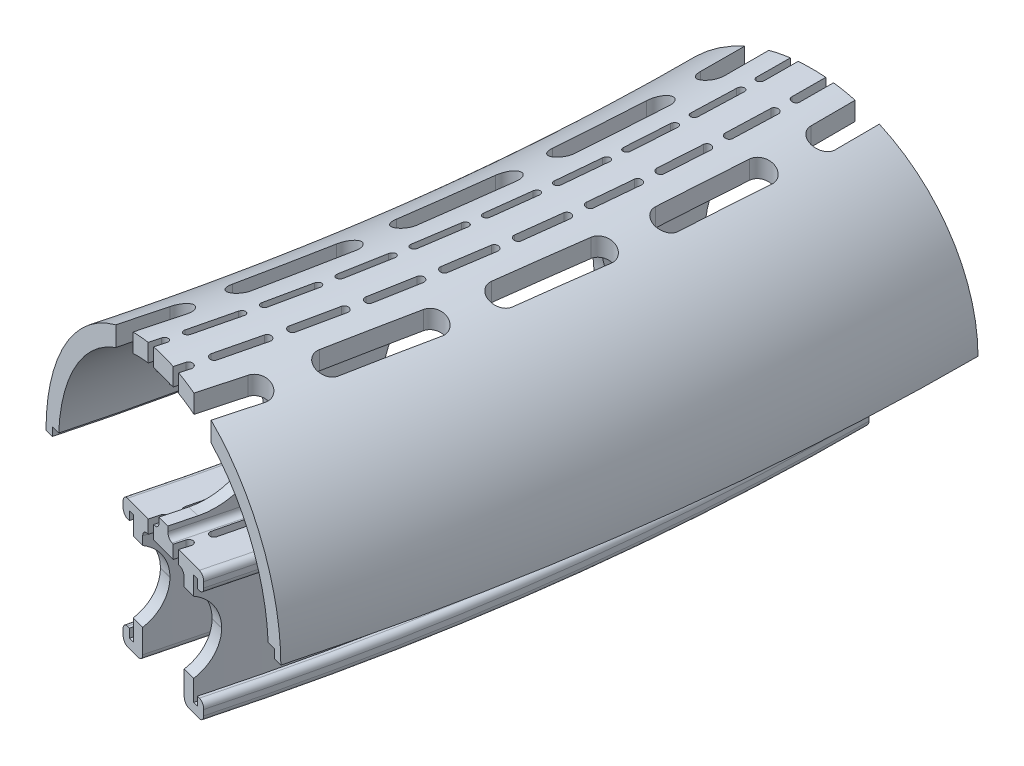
SolidWorks part; units mm, degrees
ref_plane "Спереди" through (0, 0, 0) normal (0, 0, 1) x (1, 0, 0)
ref_plane "Сверху" through (0, 0, 0) normal (0, 1, 0) x (1, 0, 0)
ref_plane "Справа" through (0, 0, 0) normal (1, 0, 0) x (0, 0, -1)
sketch "Эскиз1" plane through (0, 0, 0) normal (0, 0, 1) x (1, 0, 0)
  line L29 (195.65, 0.25) -> (196.15, 0.25)
  line L31 (195.65, -9.75) -> (196.15, -9.75)
  line L33 (195.4, -0.55) -> (195.65, -0.55)
  line L35 (195.4, -8.95) -> (195.65, -8.95)
  line L40 (195.65, 0.25) -> (195.65, -0.55)
  line L46 (194.85, -10) -> (194.85, -9.5)
  line L50 (194.85, 0) -> (194.85, 0.5)
  line L51 (195.65, -8.95) -> (195.65, -9.75)
  line L52 (196.15, 0.25) -> (196.15, -9.75)
  line L56 (185.8213, 0.7768) -> (186.6225, 0.7768)
  line L58 (185, 0) -> (185.8, 0)
  line L62 (214.2, 0) -> (215, 0)
  line L63 (213.3775, 0.7768) -> (214.1787, 0.7768)
  line L65 (0, 44.1102) -> (0, 0) construction
  line L68 (199.4347, 12.8015) -> (199.4347, 1.6)
  line L71 (195.4, 1.05) -> (198.8847, 1.05)
  line L72 (197.9, -0.15) -> (202.1, -0.15)
  line L73 (197.35, -0.7) -> (197.35, -10)
  line L74 (195.4, -10.55) -> (196.8, -10.55)
  line L75 (200, 12.0049) -> (200, -5.7785) construction
  line L76 (204.6, -10.55) -> (203.2, -10.55)
  line L77 (202.65, -0.7) -> (202.65, -10)
  line L78 (204.6, 1.05) -> (201.1153, 1.05)
  line L79 (200.5653, 12.8015) -> (200.5653, 1.6)
  line L80 (203.85, 0.25) -> (203.85, -9.75)
  line L81 (204.35, -8.95) -> (204.35, -9.75)
  line L82 (205.15, 0) -> (205.15, 0.5)
  line L83 (205.15, -10) -> (205.15, -9.5)
  line L84 (204.35, 0.25) -> (204.35, -0.55)
  line L85 (204.6, -8.95) -> (204.35, -8.95)
  line L86 (204.6, -0.55) -> (204.35, -0.55)
  line L87 (204.35, -9.75) -> (203.85, -9.75)
  line L88 (204.35, 0.25) -> (203.85, 0.25)
  arc A0 (215, 0) -> (185, 0) centre (200, 0) ccw
  arc A2 (198.837, 13.3494) -> (186.6225, 0.7768) centre (200, 0) ccw
  arc A3 (194.85, 0.5) -> (195.4, 1.05) centre (195.4, 0.5) cw
  arc A4 (195.4, -0.55) -> (194.85, 0) centre (195.4, 0) cw
  arc A7 (195.4, -8.95) -> (194.85, -9.5) centre (195.4, -9.5) ccw
  arc A10 (195.4, -10.55) -> (194.85, -10) centre (195.4, -10) cw
  arc A15 (213.3775, 0.7768) -> (201.163, 13.3494) centre (200, 0) ccw
  arc A18 (185.8213, 0.7768) -> (185.8, 0) centre (200, 0) ccw
  arc A19 (214.2, 0) -> (214.1787, 0.7768) centre (200, 0) ccw
  arc A20 (214.2, 0) -> (200.6174, 14.1866) centre (200, 0) ccw construction
  arc A21 (213.4, 0) -> (200.5826, 13.3873) centre (200, 0) ccw construction
  arc A22 (199.4174, 13.3873) -> (186.6, 0) centre (200, 0) ccw construction
  arc A23 (199.3826, 14.1866) -> (185.8, 0) centre (200, 0) ccw construction
  arc A24 (198.837, 13.3494) -> (199.4347, 12.8015) centre (198.8847, 12.8015) cw
  arc A25 (200.5653, 12.8015) -> (201.163, 13.3494) centre (201.1153, 12.8015) cw
  arc A28 (197.35, -10) -> (196.8, -10.55) centre (196.8, -10) cw
  arc A29 (198.8847, 1.05) -> (199.4347, 1.6) centre (198.8847, 1.6) ccw
  arc A30 (197.9, -0.15) -> (197.35, -0.7) centre (197.9, -0.7) ccw
  arc A31 (202.1, -0.15) -> (202.65, -0.7) centre (202.1, -0.7) cw
  arc A32 (201.1153, 1.05) -> (200.5653, 1.6) centre (201.1153, 1.6) cw
  arc A33 (202.65, -10) -> (203.2, -10.55) centre (203.2, -10) ccw
  arc A34 (204.6, -10.55) -> (205.15, -10) centre (204.6, -10) ccw
  arc A35 (204.6, -8.95) -> (205.15, -9.5) centre (204.6, -9.5) cw
  arc A36 (204.6, -0.55) -> (205.15, 0) centre (204.6, 0) ccw
  arc A37 (205.15, 0.5) -> (204.6, 1.05) centre (204.6, 0.5) ccw
  point P39 (194.85, -0.55)
  point P58 (196.15, -7.55)
  point P60 (203.85, -7.55)
  point P61 (200, -0.15)
  dimension "D1" = 30
  dimension "D3" = 1.6
  dimension "D13" = 0.8
  dimension "D14" = 4.2
  dimension "D17" = 0.55
  dimension "D4" = 1.2
  dimension "D6" = 0.55
  dimension "D2" = 200
  dimension "D5" = 1.2
  dimension "D7" = 10
  dimension "D8" = 0.8
  dimension "D9" = 0.5
  dimension "D10" = 0.8
  dimension "D11" = 0.8
  dimension "D12" = 0.8
  dimension "D15" = 0.8
revolve "Повернуть1" add sketch "Эскиз1" angle 15 about L65
sketch "Эскиз3" plane through (0, 0, 0) normal (-0.2588, 0, 0.9659) x (0.9659, 0, 0.2588)
  line L0 (0, 58.5351) -> (0, -22.4397) construction
  line L31 (185, 0) -> (185.8, 0)
  line L32 (185.8213, 0.7768) -> (186.6225, 0.7768)
  line L33 (199.4347, 12.8015) -> (199.4347, 1.6)
  line L34 (198.8847, 1.05) -> (195.4, 1.05)
  line L35 (194.85, 0.5) -> (194.85, 0)
  line L36 (195.4, -0.55) -> (195.65, -0.55)
  line L37 (195.65, -0.55) -> (195.65, 0.25)
  line L38 (195.65, 0.25) -> (196.15, 0.25)
  line L39 (196.15, 0.25) -> (196.15, -9.75)
  line L40 (196.15, -9.75) -> (195.65, -9.75)
  line L41 (195.65, -9.75) -> (195.65, -8.95)
  line L42 (195.65, -8.95) -> (195.4, -8.95)
  line L43 (194.85, -9.5) -> (194.85, -10)
  line L44 (195.4, -10.55) -> (196.8, -10.55)
  line L45 (197.35, -10) -> (197.35, -0.7)
  line L46 (197.9, -0.15) -> (202.1, -0.15)
  line L47 (202.65, -0.7) -> (202.65, -10)
  line L48 (203.2, -10.55) -> (204.6, -10.55)
  line L49 (205.15, -10) -> (205.15, -9.5)
  line L50 (204.6, -8.95) -> (204.35, -8.95)
  line L51 (204.35, -8.95) -> (204.35, -9.75)
  line L52 (204.35, -9.75) -> (203.85, -9.75)
  line L53 (203.85, -9.75) -> (203.85, 0.25)
  line L54 (203.85, 0.25) -> (204.35, 0.25)
  line L55 (204.35, 0.25) -> (204.35, -0.55)
  line L56 (204.35, -0.55) -> (204.6, -0.55)
  line L57 (205.15, 0) -> (205.15, 0.5)
  line L58 (204.6, 1.05) -> (201.1153, 1.05)
  line L59 (200.5653, 1.6) -> (200.5653, 12.8015)
  line L60 (213.3775, 0.7768) -> (214.1787, 0.7768)
  line L61 (214.2, 0) -> (215, 0)
  line L63 (185.8213, 0.7768) -> (186.6225, 0.7768)
  line L64 (199.4347, 12.8015) -> (199.4347, 1.6)
  line L65 (198.8847, 1.05) -> (195.4, 1.05)
  line L66 (194.85, 0.5) -> (194.85, 0)
  line L67 (195.4, -0.55) -> (195.65, -0.55)
  line L68 (195.65, -0.55) -> (195.65, 0.25)
  line L69 (195.65, 0.25) -> (196.15, 0.25)
  line L70 (196.15, 0.25) -> (196.15, -9.75)
  line L71 (196.15, -9.75) -> (195.65, -9.75)
  line L72 (195.65, -9.75) -> (195.65, -8.95)
  line L73 (195.65, -8.95) -> (195.4, -8.95)
  line L74 (194.85, -9.5) -> (194.85, -10)
  line L75 (195.4, -10.55) -> (196.8, -10.55)
  line L76 (197.35, -10) -> (197.35, -0.7)
  line L77 (197.9, -0.15) -> (202.1, -0.15)
  line L78 (202.65, -0.7) -> (202.65, -10)
  line L79 (203.2, -10.55) -> (204.6, -10.55)
  line L80 (205.15, -10) -> (205.15, -9.5)
  line L81 (204.6, -8.95) -> (204.35, -8.95)
  line L82 (204.35, -8.95) -> (204.35, -9.75)
  line L83 (204.35, -9.75) -> (203.85, -9.75)
  line L84 (203.85, -9.75) -> (203.85, 0.25)
  line L85 (203.85, 0.25) -> (204.35, 0.25)
  line L86 (204.35, 0.25) -> (204.35, -0.55)
  line L87 (204.35, -0.55) -> (204.6, -0.55)
  line L88 (205.15, 0) -> (205.15, 0.5)
  line L89 (204.6, 1.05) -> (201.1153, 1.05)
  line L90 (200.5653, 1.6) -> (200.5653, 12.8015)
  line L91 (213.3775, 0.7768) -> (214.1787, 0.7768)
  arc A0 (214.1787, 0.7768) -> (185.8213, 0.7768) centre (200, 0) ccw
  arc A21 (215, 0) -> (185, 0) centre (200, 0) ccw
  arc A22 (185.8213, 0.7768) -> (185.8, 0) centre (200, 0) ccw
  arc A23 (198.837, 13.3494) -> (186.6225, 0.7768) centre (200, 0) ccw
  arc A24 (199.4347, 12.8015) -> (198.837, 13.3494) centre (198.8847, 12.8015) ccw
  arc A25 (198.8847, 1.05) -> (199.4347, 1.6) centre (198.8847, 1.6) ccw
  arc A26 (195.4, 1.05) -> (194.85, 0.5) centre (195.4, 0.5) ccw
  arc A27 (194.85, 0) -> (195.4, -0.55) centre (195.4, 0) ccw
  arc A28 (195.4, -8.95) -> (194.85, -9.5) centre (195.4, -9.5) ccw
  arc A29 (194.85, -10) -> (195.4, -10.55) centre (195.4, -10) ccw
  arc A30 (196.8, -10.55) -> (197.35, -10) centre (196.8, -10) ccw
  arc A31 (197.9, -0.15) -> (197.35, -0.7) centre (197.9, -0.7) ccw
  arc A32 (202.65, -0.7) -> (202.1, -0.15) centre (202.1, -0.7) ccw
  arc A33 (202.65, -10) -> (203.2, -10.55) centre (203.2, -10) ccw
  arc A34 (204.6, -10.55) -> (205.15, -10) centre (204.6, -10) ccw
  arc A35 (205.15, -9.5) -> (204.6, -8.95) centre (204.6, -9.5) ccw
  arc A36 (204.6, -0.55) -> (205.15, 0) centre (204.6, 0) ccw
  arc A37 (205.15, 0.5) -> (204.6, 1.05) centre (204.6, 0.5) ccw
  arc A38 (200.5653, 1.6) -> (201.1153, 1.05) centre (201.1153, 1.6) ccw
  arc A39 (201.163, 13.3494) -> (200.5653, 12.8015) centre (201.1153, 12.8015) ccw
  arc A40 (213.3775, 0.7768) -> (201.163, 13.3494) centre (200, 0) ccw
  arc A41 (214.2, 0) -> (214.1787, 0.7768) centre (200, 0) ccw
  arc A44 (198.837, 13.3494) -> (186.6225, 0.7768) centre (200, 0) ccw
  arc A45 (199.4347, 12.8015) -> (198.837, 13.3494) centre (198.8847, 12.8015) ccw
  arc A46 (198.8847, 1.05) -> (199.4347, 1.6) centre (198.8847, 1.6) ccw
  arc A47 (195.4, 1.05) -> (194.85, 0.5) centre (195.4, 0.5) ccw
  arc A48 (194.85, 0) -> (195.4, -0.55) centre (195.4, 0) ccw
  arc A49 (195.4, -8.95) -> (194.85, -9.5) centre (195.4, -9.5) ccw
  arc A50 (194.85, -10) -> (195.4, -10.55) centre (195.4, -10) ccw
  arc A51 (196.8, -10.55) -> (197.35, -10) centre (196.8, -10) ccw
  arc A52 (197.9, -0.15) -> (197.35, -0.7) centre (197.9, -0.7) ccw
  arc A53 (202.65, -0.7) -> (202.1, -0.15) centre (202.1, -0.7) ccw
  arc A54 (202.65, -10) -> (203.2, -10.55) centre (203.2, -10) ccw
  arc A55 (204.6, -10.55) -> (205.15, -10) centre (204.6, -10) ccw
  arc A56 (205.15, -9.5) -> (204.6, -8.95) centre (204.6, -9.5) ccw
  arc A57 (204.6, -0.55) -> (205.15, 0) centre (204.6, 0) ccw
  arc A58 (205.15, 0.5) -> (204.6, 1.05) centre (204.6, 0.5) ccw
  arc A59 (200.5653, 1.6) -> (201.1153, 1.05) centre (201.1153, 1.6) ccw
  arc A60 (201.163, 13.3494) -> (200.5653, 12.8015) centre (201.1153, 12.8015) ccw
  arc A61 (213.3775, 0.7768) -> (201.163, 13.3494) centre (200, 0) ccw
  dimension "D1" = 0
revolve "Повернуть2" add sketch "Эскиз3" angle 0.3 about L0
sketch "Эскиз5" plane through (0, -0.15, 0) normal (0, -1, 0) x (1, 0, 0)
  line L0 (193.8128, 49.4175) -> (195.1639, 43.8469) construction
  line L1 (195.4483, 49.4623) -> (196.3911, 45.575) construction
  line L2 (193.927, 55.1259) -> (194.9825, 51.2677) construction
  line L3 (194.2646, 55.2183) -> (195.3201, 51.36)
  line L4 (193.5894, 55.0336) -> (194.6449, 51.1753)
  line L5 (192.2935, 55.0336) -> (193.8061, 49.5046) construction
  line L6 (190.8404, 54.2815) -> (191.8959, 50.4233) construction
  line L7 (190.5029, 54.1892) -> (191.5583, 50.3309)
  line L8 (191.178, 54.3739) -> (192.2335, 50.5157)
  line L9 (195.7884, 49.5448) -> (196.7313, 45.6575)
  line L10 (195.1082, 49.3798) -> (196.051, 45.4925)
  line L11 (192.3385, 48.708) -> (193.2813, 44.8207) construction
  line L12 (191.9983, 48.6255) -> (192.9412, 44.7382)
  line L13 (192.6786, 48.7905) -> (193.6214, 44.9032)
  line L14 (195.1681, 43.7596) -> (196.3566, 38.152) construction
  line L15 (196.8042, 43.7568) -> (197.6336, 39.8437) construction
  line L16 (197.1466, 43.8294) -> (197.976, 39.9163)
  line L17 (196.4618, 43.6842) -> (197.2912, 39.7712)
  line L18 (193.6738, 43.0933) -> (194.5031, 39.1802) construction
  line L19 (193.3314, 43.0207) -> (194.1607, 39.1077)
  line L20 (194.0162, 43.1659) -> (194.8455, 39.2528)
  line L21 (196.3583, 38.0647) -> (197.3832, 32.4249) construction
  line L22 (197.9936, 38.0143) -> (198.7088, 34.0788) construction
  line L23 (198.338, 38.0769) -> (199.0532, 34.1413)
  line L24 (197.6493, 37.9517) -> (198.3645, 34.0162)
  line L25 (194.8452, 37.4421) -> (195.5604, 33.5066) construction
  line L26 (194.5008, 37.3795) -> (195.216, 33.444)
  line L27 (195.1895, 37.5047) -> (195.9048, 33.5692)
  line L28 (197.3823, 32.3375) -> (198.2427, 26.6704) construction
  line L29 (199.0155, 32.2396) -> (199.6159, 28.2849) construction
  line L30 (199.3615, 32.2922) -> (199.962, 28.3375)
  line L31 (198.6695, 32.1871) -> (199.2699, 28.2324)
  line L32 (195.8518, 31.7593) -> (196.4522, 27.8046) construction
  line L33 (195.5057, 31.7067) -> (196.1062, 27.7521)
  line L34 (196.1978, 31.8118) -> (196.7982, 27.8571)
  line L35 (198.2393, 26.583) -> (198.9346, 20.8932) construction
  line L36 (199.869, 26.4377) -> (200.3541, 22.4672) construction
  line L37 (200.2164, 26.4801) -> (200.7016, 22.5097)
  line L38 (199.5216, 26.3952) -> (200.0067, 22.4248)
  line L39 (196.6926, 26.0495) -> (197.1778, 22.0791) construction
  line L40 (196.3452, 26.0071) -> (196.8304, 22.0366)
  line L41 (197.04, 26.092) -> (197.5252, 22.1215)
  line L42 (198.9286, 20.8061) -> (199.4581, 15.0985) construction
  line L43 (200.5534, 20.6134) -> (200.9228, 16.6305) construction
  line L44 (200.9019, 20.6457) -> (201.2713, 16.6628)
  line L45 (200.2049, 20.581) -> (200.5743, 16.5981)
  line L46 (197.367, 20.3178) -> (197.7365, 16.3349) construction
  line L47 (197.0185, 20.2854) -> (197.388, 16.3025)
  line L48 (197.7155, 20.3501) -> (198.085, 16.3672)
  line L49 (199.4496, 15.0115) -> (199.8128, 9.2909) construction
  line L50 (201.068, 14.7716) -> (201.3215, 10.7796) construction
  line L51 (201.4173, 14.7938) -> (201.6708, 10.8018)
  line L52 (200.7188, 14.7494) -> (200.9722, 10.7575)
  line L53 (197.8745, 14.5688) -> (198.128, 10.5769) construction
  line L54 (197.5252, 14.5466) -> (197.7787, 10.5547)
  line L55 (198.2238, 14.591) -> (198.4773, 10.599)
  line L56 (199.8018, 9.2042) -> (199.9985, 3.4755) construction
  line L57 (201.4126, 8.9173) -> (201.5499, 4.9197) construction
  line L58 (201.7624, 8.9294) -> (201.8997, 4.9317)
  line L59 (201.0628, 8.9053) -> (201.2001, 4.9077)
  line L60 (198.2145, 8.8075) -> (198.3518, 4.8099) construction
  line L61 (197.8647, 8.7955) -> (198.002, 4.7979)
  line L62 (198.5643, 8.8195) -> (198.7016, 4.8219)
  line L63 (199.985, 3.3891) -> (200.015, -2.3429) construction
  line L64 (201.5868, 3.0555) -> (201.6077, -0.9444) construction
  line L65 (201.9368, 3.0574) -> (201.9577, -0.9426)
  line L66 (201.2368, 3.0537) -> (201.2577, -0.9462)
  line L67 (198.3868, 3.0388) -> (198.4078, -0.9612) construction
  line L68 (198.0368, 3.037) -> (198.0578, -0.963)
  line L69 (198.7368, 3.0406) -> (198.7577, -0.9593)
  arc A0 (195.7884, 49.5448) -> (195.1082, 49.3798) centre (195.4483, 49.4623) ccw
  arc A1 (196.051, 45.4925) -> (196.7313, 45.6575) centre (196.3911, 45.575) ccw
  arc A2 (191.9983, 48.6255) -> (192.6786, 48.7905) centre (192.3385, 48.708) cw
  arc A3 (193.6214, 44.9032) -> (192.9412, 44.7382) centre (193.2813, 44.8207) cw
  arc A4 (197.1466, 43.8294) -> (196.4618, 43.6842) centre (196.8042, 43.7568) ccw
  arc A5 (197.2912, 39.7712) -> (197.976, 39.9163) centre (197.6336, 39.8437) ccw
  arc A6 (193.3314, 43.0207) -> (194.0162, 43.1659) centre (193.6738, 43.0933) cw
  arc A7 (194.8455, 39.2528) -> (194.1607, 39.1077) centre (194.5031, 39.1802) cw
  arc A8 (194.2646, 55.2183) -> (193.5894, 55.0336) centre (193.927, 55.1259) ccw
  arc A9 (194.6449, 51.1753) -> (195.3201, 51.36) centre (194.9825, 51.2677) ccw
  arc A10 (190.5029, 54.1892) -> (191.178, 54.3739) centre (190.8404, 54.2815) cw
  arc A11 (192.2335, 50.5157) -> (191.5583, 50.3309) centre (191.8959, 50.4233) cw
  arc A12 (198.338, 38.0769) -> (197.6493, 37.9517) centre (197.9936, 38.0143) ccw
  arc A13 (198.3645, 34.0162) -> (199.0532, 34.1413) centre (198.7088, 34.0788) ccw
  arc A14 (194.5008, 37.3795) -> (195.1895, 37.5047) centre (194.8452, 37.4421) cw
  arc A15 (195.9048, 33.5692) -> (195.216, 33.444) centre (195.5604, 33.5066) cw
  arc A16 (199.3615, 32.2922) -> (198.6695, 32.1871) centre (199.0155, 32.2396) ccw
  arc A17 (199.2699, 28.2324) -> (199.962, 28.3375) centre (199.6159, 28.2849) ccw
  arc A18 (195.5057, 31.7067) -> (196.1978, 31.8118) centre (195.8518, 31.7593) cw
  arc A19 (196.7982, 27.8571) -> (196.1062, 27.7521) centre (196.4522, 27.8046) cw
  arc A20 (200.2164, 26.4801) -> (199.5216, 26.3952) centre (199.869, 26.4377) ccw
  arc A21 (200.0067, 22.4248) -> (200.7016, 22.5097) centre (200.3541, 22.4672) ccw
  arc A22 (196.3452, 26.0071) -> (197.04, 26.092) centre (196.6926, 26.0495) cw
  arc A23 (197.5252, 22.1215) -> (196.8304, 22.0366) centre (197.1778, 22.0791) cw
  arc A24 (200.9019, 20.6457) -> (200.2049, 20.581) centre (200.5534, 20.6134) ccw
  arc A25 (200.5743, 16.5981) -> (201.2713, 16.6628) centre (200.9228, 16.6305) ccw
  arc A26 (197.0185, 20.2854) -> (197.7155, 20.3501) centre (197.367, 20.3178) cw
  arc A27 (198.085, 16.3672) -> (197.388, 16.3025) centre (197.7365, 16.3349) cw
  arc A28 (201.4173, 14.7938) -> (200.7188, 14.7494) centre (201.068, 14.7716) ccw
  arc A29 (200.9722, 10.7575) -> (201.6708, 10.8018) centre (201.3215, 10.7796) ccw
  arc A30 (197.5252, 14.5466) -> (198.2238, 14.591) centre (197.8745, 14.5688) cw
  arc A31 (198.4773, 10.599) -> (197.7787, 10.5547) centre (198.128, 10.5769) cw
  arc A32 (201.7624, 8.9294) -> (201.0628, 8.9053) centre (201.4126, 8.9173) ccw
  arc A33 (201.2001, 4.9077) -> (201.8997, 4.9317) centre (201.5499, 4.9197) ccw
  arc A34 (197.8647, 8.7955) -> (198.5643, 8.8195) centre (198.2145, 8.8075) cw
  arc A35 (198.7016, 4.8219) -> (198.002, 4.7979) centre (198.3518, 4.8099) cw
  arc A36 (201.9368, 3.0574) -> (201.2368, 3.0537) centre (201.5868, 3.0555) ccw
  arc A37 (201.2577, -0.9462) -> (201.9577, -0.9426) centre (201.6077, -0.9444) ccw
  arc A38 (198.0368, 3.037) -> (198.7368, 3.0406) centre (198.3868, 3.0388) cw
  arc A39 (198.7577, -0.9593) -> (198.0578, -0.963) centre (198.4078, -0.9612) cw
  point P4 (195.9197, 47.5186)
  point P14 (194.4548, 53.1968)
  point P24 (191.3682, 52.3524)
  point P29 (192.8099, 46.7644)
  point P36 (197.2189, 41.8003)
  point P45 (194.0884, 41.1368)
  point P52 (198.3512, 36.0465)
  point P61 (195.2028, 35.4744)
  point P68 (199.3157, 30.2623)
  point P77 (196.152, 29.7819)
  point P84 (200.1116, 24.4524)
  point P93 (196.9352, 24.0643)
  point P100 (200.7381, 18.6219)
  point P109 (197.5518, 18.3263)
  point P116 (201.1948, 12.7756)
  point P125 (198.0012, 12.5728)
  point P132 (201.4812, 6.9185)
  point P141 (198.2831, 6.8087)
  point P148 (201.5972, 1.0556)
  point P157 (198.3973, 1.0388)
  point P162 (0, 0)
  dimension "D1" = 4
  dimension "D2" = 10
  dimension "D3" = 0.7
extrude "Вырез-Вытянуть1" cut sketch "Эскиз5" against normal blind 20
ref_plane "Плоскость1" through (0, 2.05, 0) normal (0, 1, 0) x (1, 0, 0)
sketch "Эскиз6" plane through (0, 2.05, 0) normal (0, 1, 0) x (1, 0, 0)
  line L3 (198.9552, -9.8734) -> (200.5533, -9.9511)
  line L4 (198.9552, 7.7728) -> (200.5533, 7.8505)
  line L5 (195.9643, -35.7578) -> (197.5386, -36.0435)
  line L6 (198.2676, -18.2626) -> (199.8622, -18.3941)
  line L7 (189.6205, -61.0304) -> (191.144, -61.5191)
  line L8 (194.1877, -43.9855) -> (195.7514, -44.324)
  arc A6 (200.5533, -9.9511) -> (200.7973, -1.0503) centre (0, 0) ccw
  arc A7 (200.5533, 7.8505) -> (200.7973, -1.0503) centre (0, -2.1007) cw
  arc A8 (198.9552, 7.7728) -> (199.1972, -1.0503) centre (0, -2.1007) cw
  arc A9 (198.9552, -9.8734) -> (199.1972, -1.0503) centre (0, 0) ccw
  arc A10 (197.5386, -36.0435) -> (198.9423, -27.2506) centre (0, 0) ccw
  arc A11 (199.8622, -18.3941) -> (198.9423, -27.2506) centre (-0.2742, -2.0827) cw
  arc A12 (198.2676, -18.2626) -> (197.356, -27.0418) centre (-0.2742, -2.0827) cw
  arc A13 (195.9643, -35.7578) -> (197.356, -27.0418) centre (0, 0) ccw
  arc A14 (191.144, -61.5191) -> (193.6834, -52.9847) centre (0, 0) ccw
  arc A15 (195.7514, -44.324) -> (193.6834, -52.9847) centre (-0.5437, -2.0291) cw
  arc A16 (194.1877, -43.9855) -> (192.1379, -52.5706) centre (-0.5437, -2.0291) cw
  arc A17 (189.6205, -61.0304) -> (192.1379, -52.5706) centre (0, 0) ccw
  point P29 (0, 0)
  dimension "D1" = 3
extrude "Вырез-Вытянуть3" cut sketch "Эскиз6" along normal blind 11.3
fillet "Скругление1" radius 5.6 8 edges at (195.0606, 2.05, 44.1744) (194.9696, 13.35, 44.1547) (196.7515, 2.05, 35.9007) (196.7515, 13.35, 35.9007) (199.1577, 2.05, 18.336) (199.0649, 13.35, 18.3284) (199.7542, 2.05, 9.9123) (199.7542, 13.35, 9.9123)
sketch "Эскиз7" plane through (0, -0.15, 0) normal (0, -1, 0) x (1, 0, 0)
  line L1 (188.4745, 51.5608) -> (197.3484, 53.9884) construction
  line L5 (189.8298, 48.7918) -> (191.3791, 49.1916)
  line L6 (188.2315, 54.6341) -> (189.7686, 55.0785)
  line L7 (196.0267, 50.3913) -> (197.576, 50.7912)
  line L8 (194.3797, 56.4118) -> (195.9167, 56.8562)
  arc A8 (191.3791, 49.1916) -> (189.7686, 55.0785) centre (0, 0) ccw
  arc A9 (189.8298, 48.7918) -> (188.2315, 54.6341) centre (0, 0) ccw
  arc A10 (197.576, 50.7912) -> (195.9167, 56.8562) centre (0, 0) ccw
  arc A11 (196.0267, 50.3913) -> (194.3797, 56.4118) centre (0, 0) ccw
ref_plane "Плоскость2" through (0, -1.15, 0) normal (0, -1, 0) x (-1, 0, 0)
sketch "Эскиз8" plane through (0, -1.15, 0) normal (0, -1, 0) x (-1, 0, 0)
  line L0 (-192.1232, -38.79) -> (-193.6913, -39.1082)
  line L1 (-192.3911, -45.0713) -> (-190.8329, -44.708)
  line L2 (-189.8298, -48.7918) -> (-191.3791, -49.1916)
  line L3 (-189.7686, -55.0785) -> (-188.2315, -54.6341)
  line L4 (-189.8298, -48.7918) -> (-191.3791, -49.1916)
  line L5 (-189.7686, -55.0785) -> (-188.2315, -54.6341)
  line L6 (-195.9167, -56.8562) -> (-194.3797, -56.4118)
  line L7 (-196.0267, -50.3913) -> (-197.576, -50.7912)
  line L8 (-195.9167, -56.8562) -> (-194.3797, -56.4118)
  line L9 (-196.0267, -50.3913) -> (-197.576, -50.7912)
  line L10 (-198.6239, -46.5248) -> (-197.0657, -46.1615)
  line L11 (-198.3954, -40.063) -> (-199.9634, -40.3812)
  line L12 (-193.89, -28.6819) -> (-195.4726, -28.9176)
  line L13 (-194.4863, -34.9406) -> (-192.9112, -34.6593)
  line L14 (-200.7866, -36.0659) -> (-199.2115, -35.7846)
  line L15 (-200.2202, -29.6249) -> (-201.8027, -29.8606)
  line L16 (-195.1254, -18.4951) -> (-196.7181, -18.6477)
  line L17 (-196.0484, -24.7141) -> (-194.4608, -24.5156)
  line L18 (-202.399, -25.5081) -> (-200.8113, -25.3096)
  line L19 (-201.4962, -19.1056) -> (-203.089, -19.2582)
  line L20 (-195.826, -8.2577) -> (-197.4245, -8.3267)
  line L21 (-197.0732, -14.4198) -> (-195.4773, -14.3047)
  line L22 (-203.4566, -14.8804) -> (-201.8607, -14.7653)
  line L23 (-202.22, -8.5339) -> (-203.8185, -8.6029)
  line L24 (-195.9898, 2.0023) -> (-197.5897, 2.0171)
  line L25 (-197.5577, -4.0861) -> (-195.9581, -4.0546)
  line L26 (-203.9565, -4.2119) -> (-202.3568, -4.1805)
  line L27 (-202.3895, 2.0612) -> (-203.9894, 2.0759)
  arc A0 (-193.6913, -39.1082) -> (-192.3911, -45.0713) centre (0, 0) ccw
  arc A1 (-192.1232, -38.79) -> (-190.8329, -44.708) centre (0, 0) ccw
  arc A2 (-191.3791, -49.1916) -> (-189.7686, -55.0785) centre (0, 0) ccw
  arc A3 (-189.8298, -48.7918) -> (-188.2315, -54.6341) centre (0, 0) ccw
  arc A4 (-191.3791, -49.1916) -> (-189.7686, -55.0785) centre (0, 0) ccw
  arc A5 (-189.8298, -48.7918) -> (-188.2315, -54.6341) centre (0, 0) ccw
  arc A6 (-197.576, -50.7912) -> (-195.9167, -56.8562) centre (0, 0) ccw
  arc A7 (-196.0267, -50.3913) -> (-194.3797, -56.4118) centre (0, 0) ccw
  arc A8 (-197.576, -50.7912) -> (-195.9167, -56.8562) centre (0, 0) ccw
  arc A9 (-196.0267, -50.3913) -> (-194.3797, -56.4118) centre (0, 0) ccw
  arc A10 (-199.9634, -40.3812) -> (-198.6239, -46.5248) centre (0, 0) ccw
  arc A11 (-198.3954, -40.063) -> (-197.0657, -46.1615) centre (0, 0) ccw
  arc A12 (-195.4726, -28.9176) -> (-194.4863, -34.9406) centre (0, 0) ccw
  arc A13 (-193.89, -28.6819) -> (-192.9112, -34.6593) centre (0, 0) ccw
  arc A14 (-201.8027, -29.8606) -> (-200.7866, -36.0659) centre (0, 0) ccw
  arc A15 (-200.2202, -29.6249) -> (-199.2115, -35.7846) centre (0, 0) ccw
  arc A16 (-196.7181, -18.6477) -> (-196.0484, -24.7141) centre (0, 0) ccw
  arc A17 (-195.1254, -18.4951) -> (-194.4608, -24.5156) centre (0, 0) ccw
  arc A18 (-203.089, -19.2582) -> (-202.399, -25.5081) centre (0, 0) ccw
  arc A19 (-201.4962, -19.1056) -> (-200.8113, -25.3096) centre (0, 0) ccw
  arc A20 (-197.4245, -8.3267) -> (-197.0732, -14.4198) centre (0, 0) ccw
  arc A21 (-195.826, -8.2577) -> (-195.4773, -14.3047) centre (0, 0) ccw
  arc A22 (-203.8185, -8.6029) -> (-203.4566, -14.8804) centre (0, 0) ccw
  arc A23 (-202.22, -8.5339) -> (-201.8607, -14.7653) centre (0, 0) ccw
  arc A24 (-197.5897, 2.0171) -> (-197.5577, -4.0861) centre (0, 0) ccw
  arc A25 (-195.9898, 2.0023) -> (-195.9581, -4.0546) centre (0, 0) ccw
  arc A26 (-203.9894, 2.0759) -> (-203.9565, -4.2119) centre (0, 0) ccw
  arc A27 (-202.3895, 2.0612) -> (-202.3568, -4.1805) centre (0, 0) ccw
  point P54 (0, 0)
  dimension "D1" = 0
  dimension "D2" = 0
  dimension "D3" = 6
extrude "Вырез-Вытянуть4" cut sketch "Эскиз8" along normal blind 7
fillet "Скругление2" radius 3.5 40 edges at (197.8935, -8.15, 46.3545) (200.0483, -8.15, 35.934) (201.6547, -8.15, 25.4151) (202.7085, -8.15, 14.8264) (191.5633, -8.15, 44.8783) (193.6495, -8.15, 34.7911) (195.205, -8.15, 24.6086) (196.2254, -8.15, 14.3587) (203.2067, -8.15, 4.1972) (196.7079, -8.15, 4.0694) (194.6319, -8.15, 28.7924) (192.8583, -8.15, 38.9392) (195.872, -8.15, 18.5667) (196.5753, -8.15, 8.2901) (190.556, -8.15, 48.9792) (203.0692, -8.15, 8.5706) (202.3424, -8.15, 19.1866) (201.0609, -8.15, 29.7501) (196.8498, -8.15, 50.6037) (199.2284, -8.15, 40.2321) (203.0692, -1.15, 8.5706) (196.5753, -1.15, 8.2901) (195.872, -1.15, 18.5667) (202.3424, -1.15, 19.1866) (201.0609, -1.15, 29.7501) (194.6319, -1.15, 28.7924) (192.8583, -1.15, 38.9392) (199.2284, -1.15, 40.2321) (196.8498, -1.15, 50.6037) (190.556, -1.15, 48.9792) (191.5633, -1.15, 44.8783) (193.6495, -1.15, 34.7911) (197.8935, -1.15, 46.3545) (200.0483, -1.15, 35.934) (195.205, -1.15, 24.6086) (201.6547, -1.15, 25.4151) (196.2254, -1.15, 14.3587) (202.7085, -1.15, 14.8264) (203.2067, -1.15, 4.1972) (196.7079, -1.15, 4.0694)
sketch "Эскиз9" plane through (0, 2.05, 0) normal (0, 1, 0) x (1, 0, 0)
  line L0 (204.9957, 4) -> (204.9957, -4) construction
  line L1 (206.0897, 4) -> (206.0897, -4)
  line L2 (203.9017, 4) -> (203.9017, -4)
  line L3 (215, 0) -> (201.9528, 0) construction
  line L4 (200.0027, 3.1615) -> (200.0027, -3.074) construction
  line L5 (195.0098, 4) -> (195.0098, -4) construction
  line L6 (193.9158, 4) -> (193.9158, -4)
  line L7 (196.1038, 4) -> (196.1038, -4)
  line L8 (199.7813, -9.926) -> (199.3735, -16.1482) construction
  line L9 (204.8184, -9.4159) -> (204.2952, -17.3988) construction
  line L10 (205.91, -9.4875) -> (205.3868, -17.4703)
  line L11 (203.7268, -9.3444) -> (203.2035, -17.3272)
  line L12 (194.8539, -8.7628) -> (194.3307, -16.7457) construction
  line L13 (193.7623, -8.6913) -> (193.239, -16.6741)
  line L14 (195.9455, -8.8344) -> (195.4223, -16.8172)
  line L15 (198.7044, -22.9711) -> (197.8905, -29.1533) construction
  line L16 (203.764, -22.7915) -> (202.7198, -30.7231) construction
  line L17 (204.8486, -22.9343) -> (203.8044, -30.8659)
  line L18 (202.6794, -22.6487) -> (201.6352, -30.5803)
  line L19 (193.8636, -21.4881) -> (192.8194, -29.4197) construction
  line L20 (192.779, -21.3453) -> (191.7347, -29.2769)
  line L21 (194.9482, -21.6309) -> (193.904, -29.5625)
  line L22 (196.7765, -35.9178) -> (195.56, -42.0335) construction
  line L23 (201.8371, -36.0695) -> (200.2764, -43.9158) construction
  line L24 (202.9101, -36.283) -> (201.3493, -44.1292)
  line L25 (200.7642, -35.8561) -> (199.2034, -43.7024)
  line L26 (192.0431, -34.1214) -> (190.4824, -41.9677) construction
  line L27 (190.9702, -33.908) -> (189.4094, -41.7542)
  line L28 (193.116, -34.3348) -> (191.5553, -42.1811)
  line L29 (194.0061, -48.7107) -> (192.3922, -54.7337) construction
  line L30 (199.0459, -49.1931) -> (196.9753, -56.9205) construction
  line L31 (200.1026, -49.4762) -> (198.032, -57.2036)
  line L32 (197.9892, -48.9099) -> (195.9187, -56.6374)
  line L33 (189.4003, -46.6085) -> (187.3297, -54.336) construction
  line L34 (188.3436, -46.3254) -> (186.273, -54.0528)
  line L35 (190.457, -46.8917) -> (188.3864, -54.6191)
  arc A0 (206.0897, 4) -> (203.9017, 4) centre (204.9957, 4) ccw
  arc A1 (203.9017, -4) -> (206.0897, -4) centre (204.9957, -4) ccw
  arc A2 (193.9158, 4) -> (196.1038, 4) centre (195.0098, 4) cw
  arc A3 (196.1038, -4) -> (193.9158, -4) centre (195.0098, -4) cw
  arc A4 (205.91, -9.4875) -> (203.7268, -9.3444) centre (204.8184, -9.4159) ccw
  arc A5 (203.2035, -17.3272) -> (205.3868, -17.4703) centre (204.2952, -17.3988) ccw
  arc A6 (193.7623, -8.6913) -> (195.9455, -8.8344) centre (194.8539, -8.7628) cw
  arc A7 (195.4223, -16.8172) -> (193.239, -16.6741) centre (194.3307, -16.7457) cw
  arc A8 (204.8486, -22.9343) -> (202.6794, -22.6487) centre (203.764, -22.7915) ccw
  arc A9 (201.6352, -30.5803) -> (203.8044, -30.8659) centre (202.7198, -30.7231) ccw
  arc A10 (192.779, -21.3453) -> (194.9482, -21.6309) centre (193.8636, -21.4881) cw
  arc A11 (193.904, -29.5625) -> (191.7347, -29.2769) centre (192.8194, -29.4197) cw
  arc A12 (202.9101, -36.283) -> (200.7642, -35.8561) centre (201.8371, -36.0695) ccw
  arc A13 (199.2034, -43.7024) -> (201.3493, -44.1292) centre (200.2764, -43.9158) ccw
  arc A14 (190.9702, -33.908) -> (193.116, -34.3348) centre (192.0431, -34.1214) cw
  arc A15 (191.5553, -42.1811) -> (189.4094, -41.7542) centre (190.4824, -41.9677) cw
  arc A16 (200.1026, -49.4762) -> (197.9892, -48.9099) centre (199.0459, -49.1931) ccw
  arc A17 (195.9187, -56.6374) -> (198.032, -57.2036) centre (196.9753, -56.9205) ccw
  arc A18 (188.3436, -46.3254) -> (190.457, -46.8917) centre (189.4003, -46.6085) cw
  arc A19 (188.3864, -54.6191) -> (186.273, -54.0528) centre (187.3297, -54.336) cw
  point P2 (204.9957, 0)
  point P13 (195.0098, 0)
  point P23 (204.5568, -13.4074)
  point P32 (194.5923, -12.7543)
  point P39 (203.2419, -26.7573)
  point P48 (193.3415, -25.4539)
  point P55 (201.0567, -39.9927)
  point P64 (191.2627, -38.0445)
  point P71 (198.0106, -53.0568)
  point P80 (188.365, -50.4723)
  point P85 (0, 0)
  dimension "D1" = 8
  dimension "D2" = 0
  dimension "D3" = 5
extrude "Вырез-Вытянуть5" cut sketch "Эскиз9" along normal blind 20
sketch "Эскиз10" plane through (0, 0, 0) normal (0, 1, 0) x (1, 0, 0)
  line L0 (0, 0) -> (223.175, -30.5132)
  line L1 (223.175, -30.5132) -> (249.6671, 14.721)
  line L2 (249.6671, 14.721) -> (0, 0)
  line L3 (0, 0) -> (225.424, -94.6368)
  line L4 (225.424, -94.6368) -> (223.175, -30.5132)
sketch "Эскиз11" plane through (0, 0, 0) normal (0, 1, 0) x (1, 0, 0)
  line L0 (178.6963, -47.8815) -> (207.6741, -55.6461)
  line L1 (207.6741, -55.6461) -> (211.4363, -65.4158)
  line L2 (211.4363, -65.4158) -> (162.9448, -53.3725)
  line L3 (162.9448, -53.3725) -> (178.6963, -47.8815)
extrude "Вырез-Вытянуть6" cut sketch "Эскиз11" against normal through all both and the other way through all
